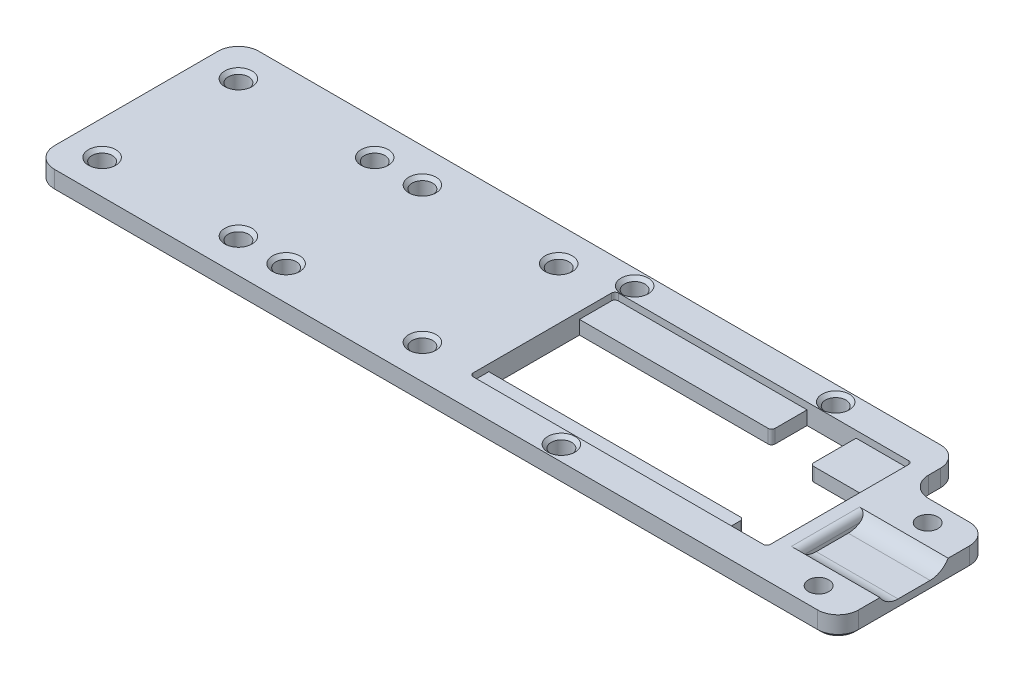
SolidWorks part; units mm, degrees
ref_plane "Front Plane" through (0, 0, 0) normal (0, 0, 1) x (1, 0, 0)
ref_plane "Top Plane" through (0, 0, 0) normal (0, 1, 0) x (1, 0, 0)
ref_plane "Right Plane" through (0, 0, 0) normal (1, 0, 0) x (0, 0, -1)
sketch "Sketch1" plane through (0, 0, 0) normal (0, 1, 0) x (1, 0, 0)
  line L1 (53, -15) -> (-53, -15)
  line L2 (53, -15) -> (53, 15)
  line L3 (53, 15) -> (-53, 15)
  line L4 (-53, -15) -> (-53, 15)
  line L5 (53, -15) -> (-53, 15) construction
  line L6 (53, 15) -> (-53, -15) construction
  point P0 (0, 0)
  dimension "D1" = 106
  dimension "D2" = 30
extrude "Boss-Extrude1" add sketch "Sketch1" along normal blind 3
sketch "Sketch2" plane through (0, 3, 0) normal (0, 1, 0) x (1, 0, 0)
  line L0 (6.8, 5.45) -> (34.8, 5.45)
  line L1 (6.8, 10.45) -> (50, 10.45)
  line L2 (6.8, 10.45) -> (6.8, -10.45)
  line L3 (6.8, -10.45) -> (50, -10.45)
  line L4 (50, 10.45) -> (50, -10.45)
  line L5 (34.8, 5.45) -> (34.8, 10.45)
  line L6 (6.8, -7.85) -> (44, -7.85)
  line L7 (44, -7.85) -> (44, -10.45)
  line L8 (42, 10.45) -> (42, 3.95)
  line L9 (42, 3.95) -> (50, 3.95)
  line L10 (53, 0) -> (50, 0) construction
  line L11 (53, -15) -> (53, 15) construction
  dimension "D1" = 20.9
  dimension "D2" = 43.2
  dimension "D3" = 28
  dimension "D4" = 5
  dimension "D5" = 2.6
  dimension "D6" = 6
  dimension "D7" = 6.5
  dimension "D8" = 8
  dimension "D9" = 3
sketch "Sketch3" plane through (0, 3, 0) normal (0, 1, 0) x (1, 0, 0)
  line L8 (6.6, 10.65) -> (6.6, -10.65)
  line L9 (6.6, -10.65) -> (50.2, -10.65)
  line L10 (50.2, -10.65) -> (50.2, 10.65)
  line L11 (50.2, 10.65) -> (6.6, 10.65)
  line L12 (6.6, 10.15) -> (6.6, -10.15)
  line L13 (7.1, -10.65) -> (49.7, -10.65)
  line L14 (50.2, -10.15) -> (50.2, 10.15)
  line L15 (49.7, 10.65) -> (7.1, 10.65)
  arc A0 (6.6, 10.15) -> (7.1, 10.65) centre (7.1, 10.15) cw
  arc A1 (6.6, -10.15) -> (7.1, -10.65) centre (7.1, -10.15) ccw
  arc A2 (50.2, -10.15) -> (49.7, -10.65) centre (49.7, -10.15) cw
  arc A3 (50.2, 10.15) -> (49.7, 10.65) centre (49.7, 10.15) ccw
  dimension "D2" = 0.5
  dimension "D1" = 0.2
extrude "Cut-Extrude1" cut sketch "Sketch3" against normal blind 1
sketch "Sketch4" plane through (0, 2, 0) normal (0, 1, 0) x (1, 0, 0)
  line L0 (34.8, 5.45) -> (34.8, 10.45) construction
  line L1 (42, 3.95) -> (50, 3.95) construction
  line L3 (44, -7.85) -> (44, -10.45) construction
  line L4 (6.8, -7.85) -> (44, -7.85) construction
  line L5 (6.8, 5.45) -> (34.8, 5.45) construction
  line L6 (34.8, 5.45) -> (34.8, 10.65)
  line L7 (42, 3.95) -> (50.2, 3.95)
  line L9 (44, -7.85) -> (44, -10.65)
  line L10 (6.6, -7.85) -> (44, -7.85)
  line L11 (6.6, 5.45) -> (34.8, 5.45)
  line L12 (6.6, 10.15) -> (6.6, -10.15) construction
  line L13 (6.6, 10.15) -> (6.6, -10.15) construction
  line L14 (7.1, -10.65) -> (49.7, -10.65) construction
  line L16 (50.2, -10.15) -> (50.2, 10.15) construction
  line L17 (49.7, 10.65) -> (7.1, 10.65) construction
  line L18 (6.6, 5.45) -> (6.6, -7.85)
  line L20 (42, 10.65) -> (34.8, 10.65)
  line L22 (42, 10.45) -> (42, 3.95) construction
  line L23 (42, 10.65) -> (42, 3.95)
  line L24 (50.2, 3.95) -> (50.2, -10.15)
  line L25 (44, -10.65) -> (49.7, -10.65)
  arc A2 (49.7, -10.65) -> (50.2, -10.15) centre (49.7, -10.15) ccw construction
  arc A3 (49.7, -10.65) -> (50.2, -10.15) centre (49.7, -10.15) ccw
extrude "Cut-Extrude2" cut sketch "Sketch4" against normal blind 2
fillet "Fillet3" radius 0.5 3 edges at (44, 1, 7.85) (34.8, 1, -5.45) (42, 1, -3.95)
sketch "Sketch5" plane through (0, 3, 0) normal (0, 1, 0) x (1, 0, 0)
  line L0 (3.6, 15) -> (3.6, -15) construction
  line L1 (53, 15) -> (-53, 15) construction
  line L2 (-53, -15) -> (53, -15) construction
  line L3 (6.6, 10.15) -> (6.6, -10.15) construction
  line L4 (-11, 0) -> (-38, 0) construction
  line L5 (2, -13) -> (-24, -13) construction
  line L6 (2, -13) -> (2, 13) construction
  line L7 (2, 13) -> (-24, 13) construction
  line L8 (-24, -13) -> (-24, 13) construction
  line L9 (2, -13) -> (-24, 13) construction
  line L10 (2, 13) -> (-24, -13) construction
  line L11 (-25, -13) -> (-51, -13) construction
  line L12 (-25, -13) -> (-25, 13) construction
  line L13 (-25, 13) -> (-51, 13) construction
  line L14 (-51, -13) -> (-51, 13) construction
  line L15 (-25, -13) -> (-51, 13) construction
  line L16 (-25, 13) -> (-51, -13) construction
  line L17 (-38, 0) -> (-53, 0) construction
  line L18 (-53, 15) -> (-53, -15) construction
  line L20 (-28, -10) -> (-48, -10) construction
  line L21 (-28, -10) -> (-28, 10) construction
  line L22 (-28, 10) -> (-48, 10) construction
  line L23 (-48, -10) -> (-48, 10) construction
  line L24 (-28, -10) -> (-48, 10) construction
  line L25 (-28, 10) -> (-48, -10) construction
  line L26 (-1, -10) -> (-21, -10) construction
  line L27 (-1, -10) -> (-1, 10) construction
  line L28 (-1, 10) -> (-21, 10) construction
  line L29 (-21, -10) -> (-21, 10) construction
  line L30 (-1, -10) -> (-21, 10) construction
  line L31 (-1, 10) -> (-21, -10) construction
  circle A0 centre (-48, 10) radius 1.5
  circle A1 centre (-48, -10) radius 1.5
  circle A2 centre (-28, -10) radius 1.5
  circle A3 centre (-28, 10) radius 1.5
  circle A4 centre (-21, 10) radius 1.5
  circle A5 centre (-1, 10) radius 1.5
  circle A6 centre (-1, -10) radius 1.5
  circle A7 centre (-21, -10) radius 1.5
  point P8 (-11, 0)
  point P13 (-38, 0)
  dimension "D6" = 3
  dimension "D1" = 3
  dimension "D2" = 26
  dimension "D3" = 2
  dimension "D4" = 1
  dimension "D5" = 20
extrude "Cut-Extrude3" cut sketch "Sketch5" against normal through all
sketch "Sketch6" plane through (0, 3, 0) normal (0, 1, 0) x (1, 0, 0)
  circle A0 centre (7.4, 12.75) radius 1.5
  circle A1 centre (36.9, 12.75) radius 1.5
  circle A2 centre (22.15, -12.75) radius 1.5
  dimension "D1" = 3
extrude "Cut-Extrude4" cut sketch "Sketch6" against normal through all
chamfer "Chamfer1" distance 0.5 angle 45 11 edges at (22.15, 3, 14.25) (-48, 3, 11.5) (-28, 3, 11.5) (-21, 3, 11.5) (-1, 3, 11.5) (36.9, 3, -11.25) (7.4, 3, -11.25) (-1, 3, -8.5) (-21, 3, -8.5) (-28, 3, -8.5) (-48, 3, -8.5)
sketch "Sketch7" plane through (53, 0, 0) normal (1, 0, 0) x (0, 0, -1)
  line L0 (-9.3, 0) -> (-9.3, 20.4754) construction
  line L1 (-15, 0) -> (15, 0) construction
  line L2 (-15, 3) -> (-15, 0) construction
  line L3 (1.6, 0) -> (1.6, 20.4754) construction
  line L4 (15, 3) -> (15, 0) construction
  line L5 (-15, 1.5) -> (15, 1.5) construction
  line L6 (-15, 7.7) -> (15, 7.7) construction
  line L7 (-6.2, 4.6) -> (-1.5, 4.6) construction
  line L8 (-6.2, 7.7) -> (-1.5, 7.7)
  line L9 (-6.2, 1.5) -> (-1.5, 1.5)
  line L10 (-6.2, 9.7) -> (-1.5, 9.7)
  line L11 (-6.2, -0.5) -> (-1.5, -0.5)
  arc A0 (-6.2, 7.7) -> (-6.2, 1.5) centre (-6.2, 4.6) ccw
  arc A1 (-1.5, 1.5) -> (-1.5, 7.7) centre (-1.5, 4.6) ccw
  arc A2 (-1.5, -0.5) -> (-1.5, 9.7) centre (-1.5, 4.6) ccw
  arc A3 (-6.2, 9.7) -> (-6.2, -0.5) centre (-6.2, 4.6) ccw
  point P17 (-3.85, 4.6)
extrude "Boss-Extrude2" add sketch "Sketch7" along normal blind 12
sketch "Sketch8" plane through (0, 0, 0) normal (0, -1, 0) x (1, 0, 0)
  line L0 (65, 6.2) -> (65, 1.5) construction
  line L1 (53, -15) -> (65, -15)
  line L2 (53, -15) -> (53, 15)
  line L3 (53, 15) -> (65, 15)
  line L4 (65, -15) -> (65, 15)
  line L5 (-53, 15) -> (53, 15) construction
extrude "Cut-Extrude5" cut sketch "Sketch8" along normal blind 12
fillet "Fillet5" radius 1 1 edges at (53, 3, 3.85)
sketch "Sketch11" plane through (0, 0, 0) normal (0, -1, 0) x (1, 0, 0)
  line L0 (53, 3.85) -> (65, 3.85) construction
  line L1 (53, 15) -> (65, 15)
  line L2 (53, 15) -> (53, -7.3)
  line L3 (53, -7.3) -> (65, -7.3)
  line L4 (65, 15) -> (65, -7.3)
  line L6 (59, 6.2) -> (59, 1.5) construction
  line L8 (65, -0.7023) -> (65, 8.4023) construction
  line L9 (65, 6.2) -> (53, 6.2) construction
  line L10 (65, 1.5) -> (53, 1.5) construction
  line L11 (59, 11.85) -> (59, -4.15) construction
  circle A0 centre (59, 11.85) radius 1.5 construction
  circle A1 centre (59, -4.15) radius 1.5 construction
  point P17 (59, 3.85)
  point P21 (59, 3.85)
  dimension "D1" = 3
  dimension "D2" = 16
extrude "Boss-Extrude4" add sketch "Sketch11" against normal up to surface (3 mm away) contours L4 L1 A0 M40 M39 | L4 L3 A1 M37 M36
sketch "Sketch12" plane through (65, 0, 0) normal (1, 0, 0) x (0, 0, -1)
  line L0 (-6.2, 4.6) -> (-1.5, 4.6) construction
  line L1 (-6.2, 7.7) -> (-1.5, 7.7)
  line L2 (-6.2, 1.5) -> (-1.5, 1.5)
  line L3 (-1.5, 7.7) -> (-6.2, 7.7) construction
  line L4 (-6.2, 1.5) -> (-1.5, 1.5) construction
  arc A0 (-6.2, 7.7) -> (-6.2, 1.5) centre (-6.2, 4.6) ccw
  arc A1 (-1.5, 1.5) -> (-1.5, 7.7) centre (-1.5, 4.6) ccw
  arc A2 (-6.2, 7.7) -> (-8.8552, 3) centre (-6.2, 4.6) ccw construction
  arc A3 (1.1552, 3) -> (-1.5, 7.7) centre (-1.5, 4.6) ccw construction
  point P2 (-3.85, 4.6)
  point P9 (-3.85, 7.7)
extrude "Cut-Extrude6" cut sketch "Sketch12" against normal up to surface (12 mm away)
sketch "Sketch14" plane through (65, 0, 0) normal (1, 0, 0) x (0, 0, -1)
  line L0 (-6.2, 1.5) -> (-1.5, 1.5) construction
  line L1 (-1.5, 7.7) -> (-6.2, 7.7) construction
  line L2 (-6.2, 1.5) -> (-1.5, 1.5)
  line L3 (-1.5, 7.7) -> (-6.2, 7.7)
  arc A0 (-6.2, 7.7) -> (-6.2, 1.5) centre (-6.2, 4.6) ccw construction
  arc A1 (-1.5, 1.5) -> (-1.5, 7.7) centre (-1.5, 4.6) ccw construction
  arc A2 (-6.2, 7.7) -> (-6.2, 1.5) centre (-6.2, 4.6) ccw
  arc A3 (-1.5, 1.5) -> (-1.5, 7.7) centre (-1.5, 4.6) ccw
sketch "Sketch13" plane through (65, 0, 0) normal (1, 0, 0) x (0, 0, -1)
  line L0 (-9.3, 4.6) -> (1.6, 4.6) construction
  line L1 (-1.5, 9.7) -> (-6.2, 9.7) construction
  line L2 (-12.3, 10.7) -> (4.6, 10.7)
  line L3 (-12.3, 10.7) -> (-12.3, 3)
  line L4 (-12.3, 3) -> (4.6, 3)
  line L5 (4.6, 10.7) -> (4.6, 3)
  line L6 (-3.85, 4.6) -> (-3.85, 3) construction
  line L7 (-15, 3) -> (-11.0425, 3) construction
  arc A0 (-6.2, 7.7) -> (-6.2, 1.5) centre (-6.2, 4.6) ccw construction
  arc A1 (-1.5, 1.5) -> (-1.5, 7.7) centre (-1.5, 4.6) ccw construction
  arc A2 (-6.2, 9.7) -> (-11.0425, 3) centre (-6.2, 4.6) ccw construction
  arc A3 (3.3425, 3) -> (-1.5, 9.7) centre (-1.5, 4.6) ccw construction
  point P12 (-11.3, 4.6)
  point P13 (3.6, 4.6)
  dimension "D1" = 1
  dimension "D2" = 1
  dimension "D3" = 1
extrude "Cut-Extrude7" cut sketch "Sketch13" against normal up to next
sketch "Sketch15" plane through (0, 0, 0) normal (0, -1, 0) x (1, 0, 0)
  circle A0 centre (59, -4.15) radius 1.5 construction
  circle A1 centre (59, 11.85) radius 1.5 construction
  circle A2 centre (59, -4.15) radius 1.5
  circle A3 centre (59, 11.85) radius 1.5
extrude "Cut-Extrude8" cut sketch "Sketch15" against normal through all
fillet "Fillet6" radius 3 6 edges at (53, 1.5, -15) (65, 1.5, 15) (65, 1.5, -7.3) (-53, 1.5, 15) (-53, 1.5, -15) (53, 1.5, -7.3)
chamfer "Chamfer2" distance 0.5 angle 45 12 edges at (0, 0, -15) (-53, 0, 0) (6, 0, 15) (53, 0, -11.15) (65, 0, 3.85) (52.1213, 0, -14.1213) (53.8787, 0, -8.1787) (59, 0, -7.3) (-52.1213, 0, -14.1213) (64.1213, 0, -6.4213) (-52.1213, 0, 14.1213) (64.1213, 0, 14.1213)
equation "\"D1@Sketch7\"=6.40mm-.7"
